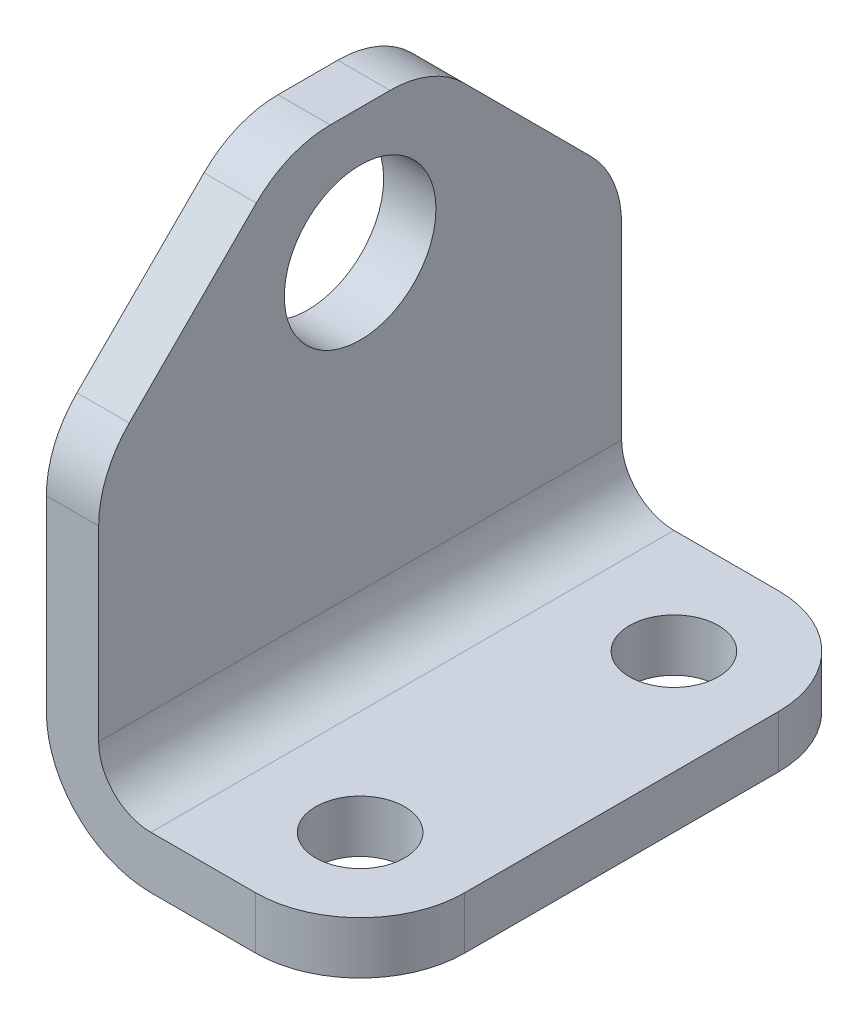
SolidWorks part; units mm, degrees
ref_plane "Plan de face" through (0, 0, 0) normal (0, 0, 1) x (1, 0, 0)
ref_plane "Plan de dessus" through (0, 0, 0) normal (0, 1, 0) x (1, 0, 0)
ref_plane "Plan de droite" through (0, 0, 0) normal (1, 0, 0) x (0, 0, -1)
sketch "Esquisse1" plane through (0, 0, 0) normal (0, 0, 1) x (1, 0, 0)
  line L1 (0, 50) -> (5, 50)
  line L2 (0, 50) -> (0, 0)
  line L4 (5, 50) -> (5, 5)
  line L5 (5, 5) -> (30, 5)
  line L7 (0, 0) -> (30, 0)
  line L8 (30, 5) -> (30, 0)
  dimension "D1" = 30
  dimension "D2" = 50
  dimension "D3" = 5
  dimension "D4" = 5
extrude "Boss.-Extru.1" add sketch "Esquisse1" along normal blind 50
fillet "Congé1" radius 5 1 edges at (5, 5, 25)
fillet "Congé2" radius 10 1 edges at (0, 0, 25)
sketch "Esquisse2" plane through (0, 0, 0) normal (0, -1, 0) x (1, 0, 0)
  line L0 (30, 50) -> (30, 0) construction
  line L1 (-9.6313, 25) -> (53.674, 25) construction
  circle A0 centre (20, 40) radius 4.25
  circle A1 centre (20, 10) radius 4.25
  point P8 (30, 25)
  dimension "D1" = 8.5
  dimension "D2" = 30
  dimension "D3" = 10
  dimension "D4" = 15
extrude "Enlèv. mat.-Extru.1" cut sketch "Esquisse2" against normal through all
hole_wizard "Trou taraudé M16x1.51" positions "Esquisse4" profile "Esquisse3" tap size "M16x1.5" standard "Iso"
sketch "Esquisse4" plane through (5, 0, 0) normal (1, 0, 0) x (0, 0, -1)
  line L0 (-50, 50) -> (0, 50) construction
  point P0 (-25, 38)
  point P5 (-25, 50)
  dimension "D1" = 12
sketch "Esquisse3" plane through (5, 38, 25) normal (0, 1, 0) x (0, 0, -1)
  line L0 (0, 0) -> (0, 5)
  line L1 (0, 5) -> (7.25, 5)
  line L2 (7.25, 5) -> (7.25, 0)
  line L5 (7.25, 0) -> (0, 0)
  line L11 (0, -6.35) -> (0, 107.95) construction
  dimension "Diamètre du trou pour taraudage jusqu'au prochain" = 14.5
  dimension "Profondeur du trou pour taraudage jusqu'au prochain" = 5
chamfer "Chanfrein1" distance 18 angle 45 2 edges at (2.5, 50, 0) (2.5, 50, 50)
fillet "Congé3" radius 10 6 edges at (30, 2.5, 0) (30, 2.5, 50) (2.5, 32, 50) (2.5, 32, 0) (2.5, 50, 18) (2.5, 50, 32)
